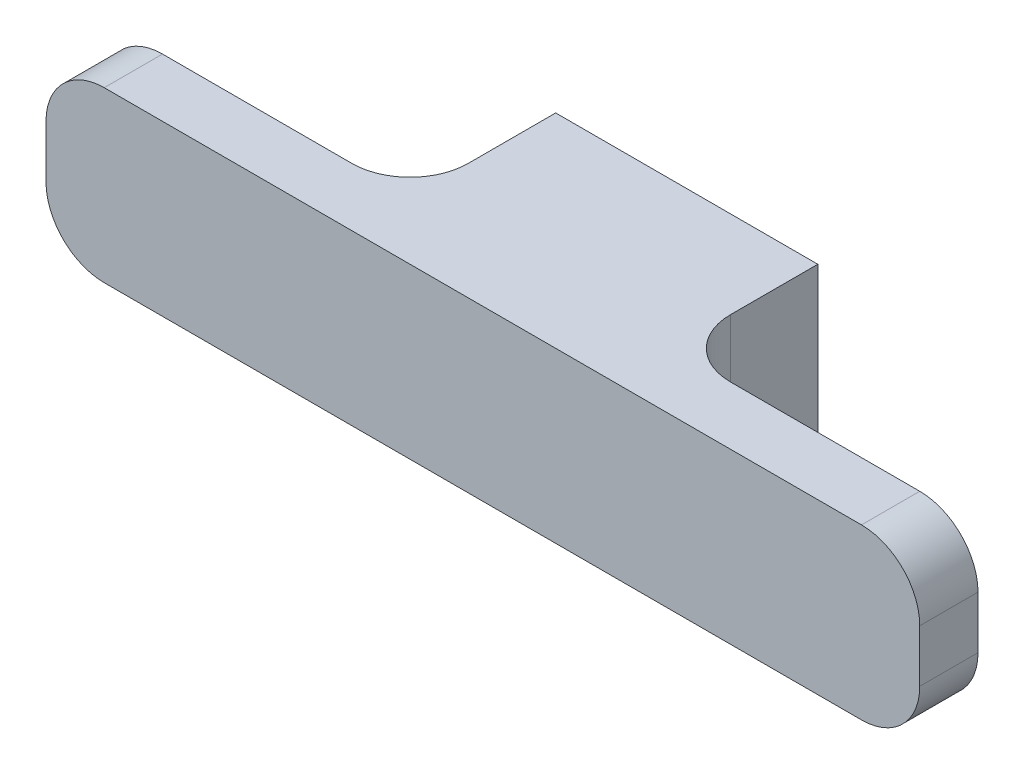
SolidWorks part; units mm, degrees
ref_plane "Alzado" through (0, 0, 0) normal (0, 0, 1) x (1, 0, 0)
ref_plane "Planta" through (0, 0, 0) normal (0, 1, 0) x (1, 0, 0)
ref_plane "Vista lateral" through (0, 0, 0) normal (1, 0, 0) x (0, 0, -1)
sketch "Croquis1" plane through (0, 0, 0) normal (0, 0, 1) x (1, 0, 0)
  line L1 (-2.25, -1.45) -> (2.25, -1.45)
  line L2 (-2.25, -1.45) -> (-2.25, 1.45)
  line L3 (-2.25, 1.45) -> (2.25, 1.45)
  line L4 (2.25, -1.45) -> (2.25, 1.45)
  line L5 (-2.25, -1.45) -> (2.25, 1.45) construction
  line L6 (-2.25, 1.45) -> (2.25, -1.45) construction
  point P0 (0, 0)
  dimension "D1" = 2.9
  dimension "D2" = 4.5
extrude "Saliente-Extruir1" add sketch "Croquis1" along normal blind 2.5
sketch "Croquis2" plane through (0, 0, 2.5) normal (0, 0, 1) x (1, 0, 0)
  line L0 (2.25, 1.45) -> (-2.25, 1.45) construction
  line L1 (-7.5, -1.45) -> (7.5, -1.45)
  line L2 (-7.5, -1.45) -> (-7.5, 1.45)
  line L3 (-7.5, 1.45) -> (7.5, 1.45)
  line L4 (7.5, -1.45) -> (7.5, 1.45)
  line L5 (-7.5, -1.45) -> (7.5, 1.45) construction
  line L6 (-7.5, 1.45) -> (7.5, -1.45) construction
  point P4 (0, 0)
  dimension "D1" = 15
extrude "Saliente-Extruir2" add sketch "Croquis2" along normal blind 1
fillet "Redondeo1" radius 1 2 edges at (2.25, 0, 2.5) (-2.25, 0, 2.5)
fillet "Redondeo2" radius 1 4 edges at (-7.5, 1.45, 3) (-7.5, -1.45, 3) (7.5, 1.45, 3) (7.5, -1.45, 3)
